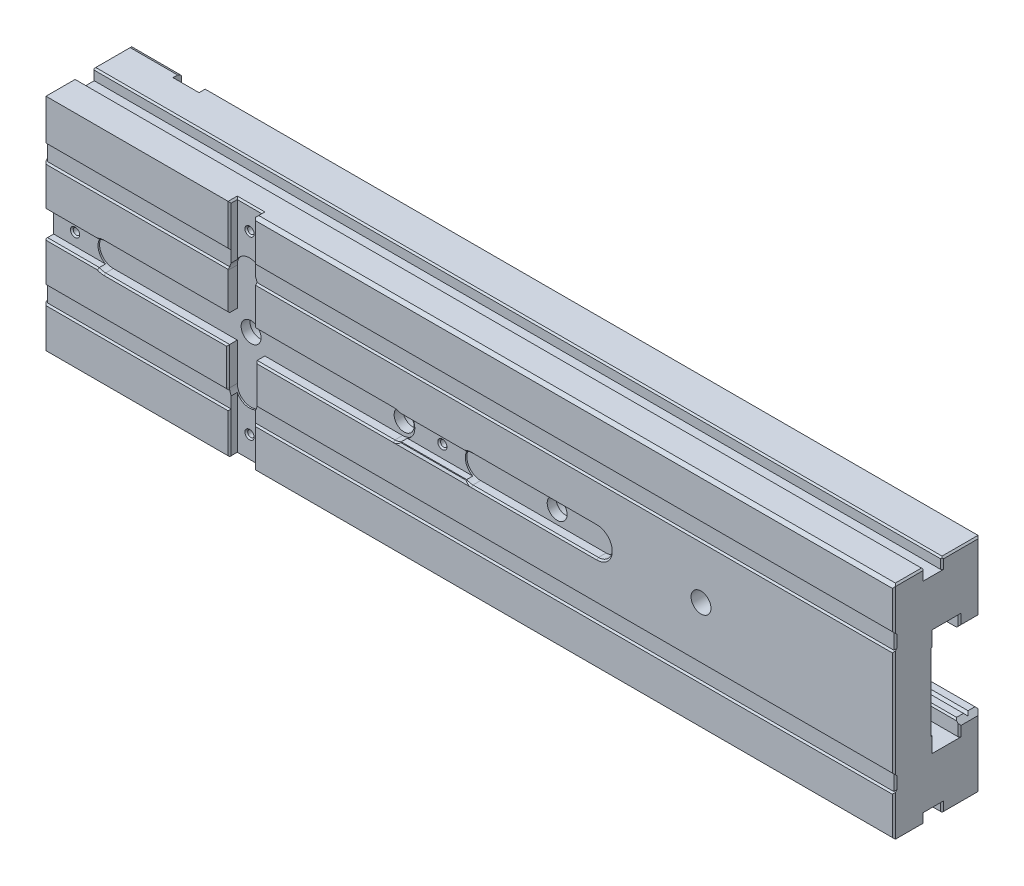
SolidWorks part; units mm, degrees
ref_plane "Front Plane" through (0, 0, 0) normal (0, 0, 1) x (1, 0, 0)
ref_plane "Top Plane" through (0, 0, 0) normal (0, 1, 0) x (1, 0, 0)
ref_plane "Right Plane" through (0, 0, 0) normal (1, 0, 0) x (0, 0, -1)
imported_body "Imported1"
sketch "Sketch1" plane through (0, 0, -24.2) normal (0, 0, -1) x (-1, 0, 0)
  circle A0 centre (148.5, 0) radius 10
  circle A1 centre (48.5, 0) radius 10
  circle A2 centre (-51.5, 0) radius 10
extrude "Boss-Extrude1" add sketch "Sketch1" against normal up to surface (18.2 mm away)
sketch "Sketch2" plane through (0, 0, -24.2) normal (0, 0, -1) x (-1, 0, 0)
  circle A0 centre (-151.5, 0) radius 10
extrude "Boss-Extrude2" add sketch "Sketch2" against normal up to surface (24.2 mm away)
hole_wizard "Hole1" positions "Sketch4" profile "Sketch3" legacy
sketch "Sketch4" plane through (0, 0, -24.2) normal (0, 0, -1) x (-1, 0, 0)
  line L0 (277.5, 25) -> (277.5, -25) construction
  point P0 (148.5, 0)
  point P13 (48.5, 0)
  point P15 (-51.5, 0)
  point P17 (-151.5, 0)
  dimension "D1" = 129
  dimension "D2" = 100
  dimension "D3" = 100
  dimension "D4" = 100
sketch "Sketch3" plane through (-148.5, 0, -24.2) normal (1, 0, 0) x (0, 1, 0)
  line L0 (0, 0) -> (0, 100)
  line L1 (0, 100) -> (6.5, 100)
  line L2 (6.5, 100) -> (6.5, 12.5)
  line L3 (6.5, 12.5) -> (9.5, 12.5)
  line L4 (9.5, 12.5) -> (9.5, 0)
  line L5 (9.5, 0) -> (0, 0)
  line L6 (0, 110) -> (0, -10) construction
  dimension "Diameter" = 13
  dimension "Depth" = 100
  dimension "C-Bore Diameter" = 19
  dimension "C-Bore Depth" = 12.5
